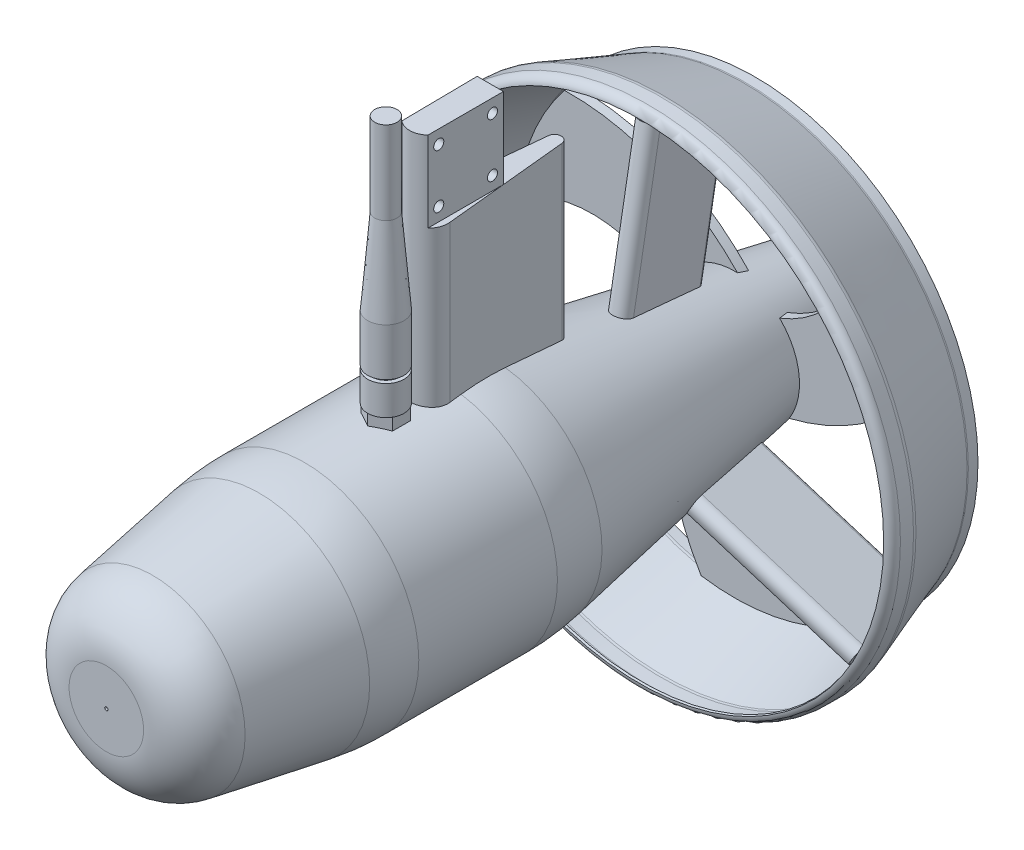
SolidWorks part; units mm, degrees
ref_plane "Front" through (0, 0, 0) normal (0, 0, 1) x (1, 0, 0)
ref_plane "Top" through (0, 0, 0) normal (0, 1, 0) x (1, 0, 0)
ref_plane "Right" through (0, 0, 0) normal (1, 0, 0) x (0, 0, -1)
sketch "Sketch1" plane through (0, 0, 0) normal (1, 0, 0) x (0, 0, -1)
  line L0 (0, 0) -> (342.9, 0) construction
  line L1 (304.8, 104.3777) -> (304.8, 94.6891)
  line L2 (251.968, 115.189) -> (251.968, 107.1482)
  line L3 (255.143, 118.364) -> (261.3326, 118.364)
  line L4 (262.4093, 118.1759) -> (300.1684, 104.5658)
  line L5 (0, 17.6154) -> (0, 1.7573)
  line L6 (288.0829, 31.2173) -> (339.4464, 21.7498)
  line L7 (0, 1.7573) -> (288.0829, 1.7573)
  line L8 (339.4464, 21.7498) -> (339.4464, 8.3748)
  line L9 (301.245, 104.3777) -> (304.8, 104.3777)
  line L10 (254.321, 104.0815) -> (300.803, 91.6224)
  line L11 (339.4464, 1.7573) -> (288.0829, 1.7573)
  line L12 (181.3362, 50.893) -> (288.0829, 31.2173)
  line L14 (339.4464, 8.3748) -> (342.9, 8.3748)
  line L16 (339.4464, 1.7573) -> (342.9, 1.7573)
  line L17 (342.9, 8.3748) -> (342.9, 1.7573)
  line L18 (21.1486, 42.6571) -> (71.4996, 51.2053)
  line L20 (123.7, 52.997) -> (132.7498, 52.997)
  line L21 (92.7567, 52.997) -> (158.3151, 52.997)
  arc A0 (251.968, 115.189) -> (255.143, 118.364) centre (255.143, 115.189) cw
  arc A1 (262.4093, 118.1759) -> (261.3326, 118.364) centre (261.3326, 115.189) ccw
  arc A2 (300.1684, 104.5658) -> (301.245, 104.3777) centre (301.245, 107.5527) ccw
  arc A3 (301.245, 104.3777) -> (300.1684, 104.5658) centre (301.245, 107.5527) cw
  arc A4 (261.3326, 118.364) -> (262.4093, 118.1759) centre (261.3326, 115.189) cw
  arc A5 (262.4093, 118.1759) -> (261.3326, 118.364) centre (261.3326, 115.189) ccw
  arc A6 (254.321, 104.0815) -> (251.968, 107.1482) centre (255.143, 107.1482) cw
  arc A7 (304.8, 94.6891) -> (300.803, 91.6224) centre (301.625, 94.6891) cw
  arc A11 (21.1486, 42.6571) -> (0, 17.6154) centre (25.4, 17.6154) ccw
  arc A12 (92.7567, 52.997) -> (71.4996, 51.2053) centre (92.7567, -74.003) ccw
  arc A13 (181.3362, 50.893) -> (158.3151, 52.997) centre (158.3151, -74.003) ccw
  dimension "D6" = 3.175
  dimension "D7" = 3.175
  dimension "D8" = 3.175
  dimension "D10" = 3.175
  dimension "D1" = 342.9
  dimension "D2" = 38.1
  dimension "D3" = 90.932
  dimension "D4" = 118.364
revolve "Revolve-Thin3" add sketch "Sketch1" angle 360 about L0
sketch "Sketch2" plane through (0, 0, 0) normal (1, 0, 0) x (0, 0, -1)
  line L2 (245.9536, 112.6545) -> (319.8789, 94.6577)
  line L5 (0, 0) -> (-16.7781, 0) construction
  line L6 (245.9536, 112.6545) -> (245.9536, 85.9292)
  line L8 (245.9536, 85.9292) -> (319.8789, 85.9292)
  line L11 (319.8789, 85.9292) -> (319.8789, 94.6577)
revolve "Cut-Revolve1" cut sketch "Sketch2" angle 360 about L5
sketch "Sketch3" plane through (0, 0, 0) normal (1, 0, 0) x (0, 0, -1)
  line L0 (234.8897, 120.0465) -> (326.3862, 94.7042)
  line L1 (234.8897, 120.0465) -> (234.8897, 81.0027)
  line L2 (234.8897, 81.0027) -> (326.3862, 81.0027)
  line L3 (326.3862, 81.0027) -> (326.3862, 94.7042)
  line L4 (0, 0) -> (-19.0142, 0) construction
revolve "Cut-Revolve2" cut sketch "Sketch3" angle 360 about L4
sketch "Sketch4" plane through (0, 0, -304.8) normal (0, 0, 1) x (1, 0, 0)
  circle A0 centre (0, 0) radius 104.3777
  circle A1 centre (0, 0) radius 104.3777 construction
  circle A2 centre (0, 0) radius 91.6343
extrude "Cut-Extrude1" cut sketch "Sketch4" against normal blind 10.16
sketch "Sketch5" plane through (0, 0, 0) normal (0, 1, 0) x (1, 0, 0)
  line L0 (0, 305.8) -> (0, 232.3807) construction
  line L1 (105.3777, 305.8) -> (-105.3777, 305.8) construction
  line L2 (-4.7625, 235.6862) -> (4.7625, 235.6862) construction
  line L3 (-4.7433, 236.1132) -> (-1.5811, 271.2429)
  line L5 (4.7433, 236.1132) -> (1.5811, 271.2429)
  line L6 (-1.5808, 296.1293) -> (1.5808, 296.1293) construction
  line L10 (-1.5875, 271.1005) -> (1.5875, 271.1005) construction
  arc A2 (-4.7433, 236.1132) -> (4.7433, 236.1132) centre (0, 235.6862) ccw
  arc A3 (1.5811, 271.2429) -> (-1.5811, 271.2429) centre (0, 271.1005) ccw
  dimension "D1" = 4.7625
  dimension "D2" = 1.5875
sketch "Sketch7" plane through (0, 0, -343.9) normal (0, 0, -1) x (-1, 0, 0)
  line L0 (-9.3748, 0) -> (9.3748, 0) construction
  circle A0 centre (0, 0) radius 9.3748 construction
ref_plane "Plane1" through (0, 58.8104, -10.3699) normal (0, 0.9848, -0.1736) x (-1, 0, 0)
ref_plane "Plane2" through (0, 151.3626, -26.6893) normal (0, 0.9848, -0.1736) x (-1, 0, 0)
sketch "Sketch8" plane through (0, 58.8104, -10.3699) normal (0, 0.9848, -0.1736) x (-1, 0, 0)
  line L0 (0, -360.8686) -> (0, -141.4844) construction
  line L1 (0.1649, -125.222) -> (0.1649, -198.6413) construction
  line L2 (-1.4226, -261.5326) -> (1.7524, -261.5326) construction
  line L3 (-4.5976, -226.1183) -> (4.9274, -226.1183) construction
  line L5 (-1.4159, -134.8927) -> (1.7457, -134.8927) construction
  line L7 (-1.5875, -267.8581) -> (1.5875, -267.8581) construction
  line L8 (-1.4226, -253.0031) -> (1.7524, -253.0031) construction
  line L9 (-4.7625, -232.4438) -> (4.7625, -232.4438) construction
  line L10 (4.7433, -232.8707) -> (1.5811, -268.0004)
  line L11 (-4.7433, -232.8707) -> (-1.5811, -268.0004)
  line L12 (-1.5875, -259.3285) -> (1.5875, -259.3285) construction
  line L13 (0, -301.1542) -> (0, -228.8503) construction
  arc A2 (1.5811, -268.0004) -> (-1.5811, -268.0004) centre (0, -267.8581) cw
  arc A3 (-4.7433, -232.8707) -> (4.7433, -232.8707) centre (0, -232.4438) cw
extrude "Extrude1" add sketch "Sketch8" along normal blind 96.868
pattern_circular "CirPattern1" count 3 over 240 about axis through (0, 0, 0) along (0, 0, 1) of "Extrude1"
ref_plane "Plane3" through (0, 0, -295.9964) normal (0, 0, -1) x (-1, 0, 0)
sketch "Sketch9" plane through (0, 0, -295.9964) normal (0, 0, -1) x (-1, 0, 0)
  line L0 (-106.5516, -61.5176) -> (-66.6932, -38.5053) construction
  line L2 (-67.191, -38.7927) -> (0, 0) construction
  line L3 (-15.7414, -9.0883) -> (17.1383, 9.8948)
  arc A0 (-43.6955, -93.3581) -> (15.7623, -101.8655) centre (0, 0) ccw
  arc A1 (15.7623, -101.8655) -> (17.1383, 9.8948) centre (-78.0458, -44.8219) ccw
  arc A3 (-43.6955, -93.3581) -> (-15.7414, -9.0883) centre (-67.191, -38.7927) ccw
extrude "Extrude2" add sketch "Sketch9" along normal blind 4.412
pattern_circular "CirPattern2" count 3 over 240 about axis through (0, 0, 0) along (0, 0, 1) of "Extrude2"
fillet "Fillet1" radius 3.175 1 edges at (22.5823, 0, -340.4464)
fillet "Fillet2" radius 0.7937 1 edges at (9.3748, 0, -343.9)
sketch "Sketch10" plane through (0, 0, -343.9) normal (0, 0, -1) x (-1, 0, 0)
  circle A0 centre (0, 0) radius 1.9293
extrude "Extrude3" add sketch "Sketch10" along normal blind 1.618
fillet "Fillet3" radius 0.7937 1 edges at (-1.9293, 0, -345.518)
sketch "Sketch11" plane through (0, 0, 0) normal (0, 1, 0) x (1, 0, 0)
  line L0 (0, 0) -> (0, 357.2512) construction
  line L6 (3.1594, 211.2365) -> (9.0167, 152.3747)
  line L7 (-3.1594, 211.2365) -> (-9.0167, 152.3747)
  arc A1 (3.1594, 211.2365) -> (-3.1594, 211.2365) centre (0, 210.9221) ccw
  arc A2 (-9.0167, 152.3747) -> (9.0167, 152.3747) centre (0, 151.4774) ccw
  dimension "D3" = 6.35
extrude "Extrude4" add sketch "Sketch11" along normal blind 127
sketch "Sketch12" plane through (0, 127, 0) normal (0, 1, 0) x (1, 0, 0)
  line L1 (-6.212, 180.5599) -> (-5.7726, 144.4929)
  line L2 (9.0167, 152.3747) -> (3.1594, 211.2365) construction
  line L4 (6.212, 180.5599) -> (6.212, 144.8807)
  line L5 (0, 151.4774) -> (0, 226.2262) construction
  line L6 (-6.212, 180.5599) -> (6.212, 180.5599)
  arc A1 (-5.7726, 144.4929) -> (6.212, 144.8807) centre (0, 151.4774) ccw
  arc A2 (-9.0167, 152.3747) -> (9.0167, 152.3747) centre (0, 151.4774) ccw construction
extrude "Extrude5" add sketch "Sketch12" along normal blind 38.1
sketch "Sketch13" plane through (-4.0116, 0, 0.0489) normal (-0.9999, 0, 0.0122) x (0.0122, 0, 0.9999)
  line L0 (-162.5873, 165.1) -> (-162.5873, 127) construction
  line L1 (-180.6222, 165.1) -> (-144.5525, 165.1) construction
  line L2 (-180.6222, 127) -> (-144.5525, 127) construction
  line L3 (-180.6222, 146.05) -> (-144.5525, 146.05) construction
  line L4 (-180.6222, 165.1) -> (-180.6222, 127) construction
  line L5 (-144.5525, 165.1) -> (-144.5525, 127) construction
  circle A0 centre (-149.8873, 133.35) radius 2.3813
  circle A1 centre (-149.8873, 158.75) radius 2.3813
  circle A2 centre (-175.2873, 158.75) radius 2.3813
  circle A3 centre (-175.2873, 133.35) radius 2.3813
  dimension "D1" = 4.7625
  dimension "D3" = 12.7
  dimension "D2" = 12.7
extrude "Cut-Extrude2" cut sketch "Sketch13" against normal through all
sketch "Sketch14" plane through (0, 0, 0) normal (0, 1, 0) x (1, 0, 0)
  line L0 (0, 151.4774) -> (0, 71.3322) construction
  line L1 (52.1912, 71.3322) -> (-52.1912, 71.3322) construction
  line L3 (0, 122.5877) -> (7.4407, 126.8836)
  line L4 (7.4407, 126.8836) -> (7.4407, 135.4754)
  line L5 (7.4407, 135.4754) -> (0, 139.7713)
  line L6 (0, 139.7713) -> (-7.4407, 135.4754)
  line L7 (-7.4407, 135.4754) -> (-7.4407, 126.8836)
  line L8 (-7.4407, 126.8836) -> (0, 122.5877)
  circle A0 centre (0, 131.1795) radius 7.4407 construction
extrude "Extrude6" add sketch "Sketch14" along normal blind 59.182
sketch "Sketch15" plane through (0, 59.182, 0) normal (0, 1, 0) x (1, 0, 0)
  line L0 (0, 139.7713) -> (0, 122.5877) construction
  circle A0 centre (0, 131.1795) radius 8.5918
extrude "Extrude7" add sketch "Sketch15" along normal blind 13.97
sketch "Sketch16" plane through (0, 73.152, 0) normal (0, 1, 0) x (1, 0, 0)
  circle A0 centre (0, 131.1795) radius 6.7123
extrude "Extrude8" add sketch "Sketch16" along normal blind 1.5875
sketch "Sketch17" plane through (0, 74.7395, 0) normal (0, 1, 0) x (1, 0, 0)
  circle A0 centre (0, 131.1795) radius 8.5918
extrude "Extrude9" add sketch "Sketch17" along normal blind 22.4155
sketch "Sketch18" plane through (0, 0, 0) normal (1, 0, 0) x (0, 0, -1)
  line L0 (139.7713, 97.155) -> (136.442, 137.4824)
  line L1 (131.1795, 97.155) -> (131.1795, 155.1154) construction
  line L2 (139.7713, 97.155) -> (122.5877, 97.155) construction
  line L4 (136.442, 137.4824) -> (136.442, 176.7157)
  line L6 (131.1795, 176.7157) -> (136.442, 176.7157)
  line L7 (131.1795, 176.7157) -> (131.1795, 97.155)
  line L8 (131.1795, 97.155) -> (139.7713, 97.155)
revolve "Revolve1" add sketch "Sketch18" angle 360 about L1
